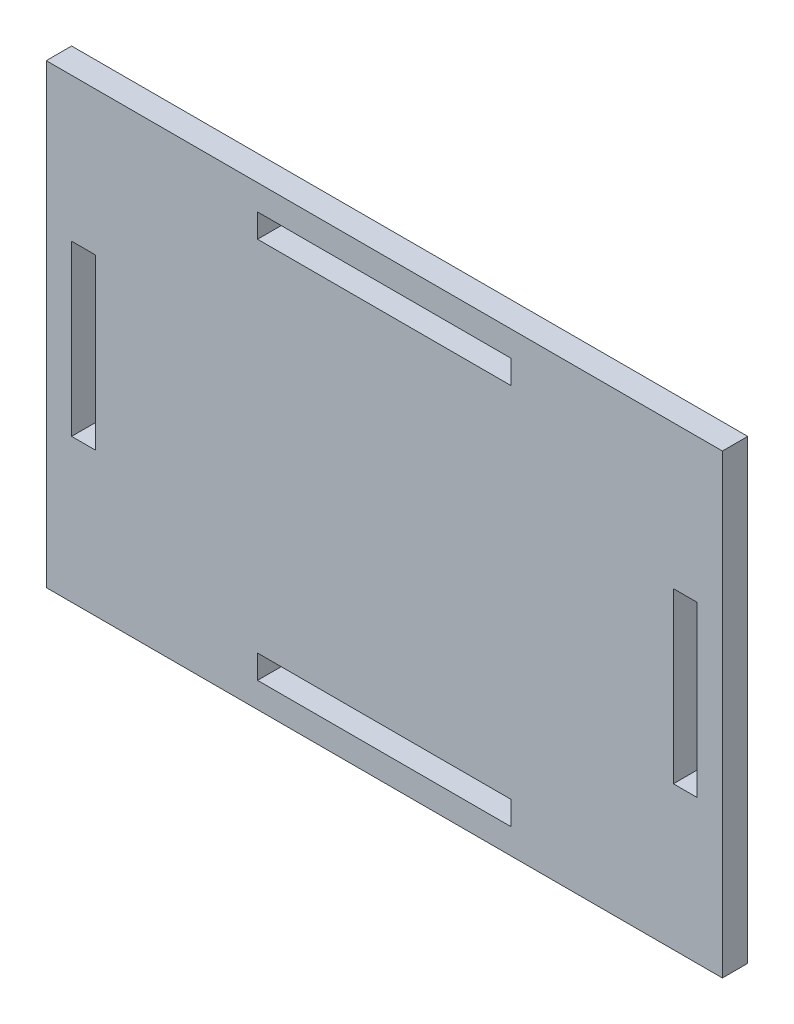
SolidWorks part; units mm, degrees
ref_plane "Alzado" through (0, 0, 0) normal (0, 0, 1) x (1, 0, 0)
ref_plane "Planta" through (0, 0, 0) normal (0, 1, 0) x (1, 0, 0)
ref_plane "Vista lateral" through (0, 0, 0) normal (1, 0, 0) x (0, 0, -1)
sketch "Croquis1" plane through (0, 0, 0) normal (0, 0, 1) x (1, 0, 0)
  line L0 (0, 0) -> (-15, 0) construction
  line L1 (-40, -27) -> (40, -27)
  line L2 (-40, -27) -> (-40, 27)
  line L3 (-40, 27) -> (40, 27)
  line L4 (40, -27) -> (40, 27)
  line L5 (-40, -27) -> (40, 27) construction
  line L6 (-40, 27) -> (40, -27) construction
  line L7 (-15, 24) -> (15, 24)
  line L8 (-15, 24) -> (-15, 21.2)
  line L9 (-15, 21.2) -> (15, 21.2)
  line L10 (15, 24) -> (15, 21.2)
  line L11 (-15, 24) -> (15, 21.2) construction
  line L12 (-15, 21.2) -> (15, 24) construction
  line L13 (-37, -10) -> (-34.2, -10)
  line L14 (-37, -10) -> (-37, 10)
  line L15 (-37, 10) -> (-34.2, 10)
  line L16 (-34.2, -10) -> (-34.2, 10)
  line L17 (-37, -10) -> (-34.2, 10) construction
  line L18 (-37, 10) -> (-34.2, -10) construction
  line L19 (0, 0) -> (0, 13.9946) construction
  line L20 (-15, -21.2) -> (15, -24) construction
  line L21 (-15, -24) -> (15, -21.2) construction
  line L22 (15, -24) -> (15, -21.2)
  line L23 (-15, -21.2) -> (15, -21.2)
  line L24 (-15, -24) -> (-15, -21.2)
  line L25 (-15, -24) -> (15, -24)
  line L26 (37, 10) -> (34.2, -10) construction
  line L27 (37, -10) -> (34.2, 10) construction
  line L28 (34.2, -10) -> (34.2, 10)
  line L29 (37, 10) -> (34.2, 10)
  line L30 (37, -10) -> (37, 10)
  line L31 (37, -10) -> (34.2, -10)
  point P0 (0, 0)
  point P6 (0, 22.6)
  point P11 (-35.6, 0)
  point P17 (0, 27)
  point P19 (-40, 0)
  point P25 (0, -22.6)
  point P30 (35.6, 0)
  dimension "D1" = 80
  dimension "D2" = 54
  dimension "D3" = 2.8
  dimension "D4" = 30
  dimension "D5" = 3
  dimension "D6" = 3
  dimension "D7" = 2.8
  dimension "D8" = 20
extrude "Saliente-Extruir1" add sketch "Croquis1" along normal blind 3
